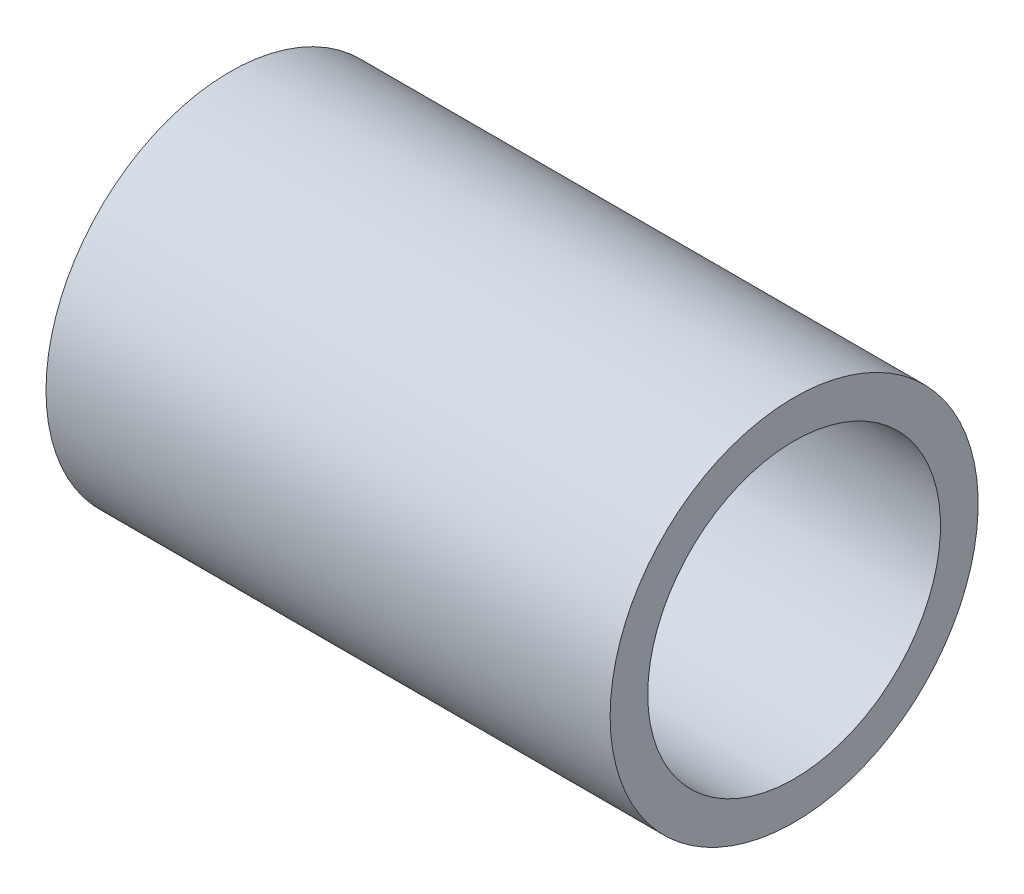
SolidWorks part; units mm, degrees
ref_plane "Front Plane" through (0, 0, 0) normal (0, 0, 1) x (1, 0, 0)
ref_plane "Top Plane" through (0, 0, 0) normal (0, 1, 0) x (1, 0, 0)
ref_plane "Right Plane" through (0, 0, 0) normal (1, 0, 0) x (0, 0, -1)
sketch "Sketch0" plane through (0, 0, 0) normal (0, 0, 1) x (1, 0, 0)
  line L0 (-20.7518, 0) -> (1.1938, 0) construction
  line L2 (-1.1938, 0) -> (1.1938, 0) construction
  line L3 (-20.7518, 0) -> (20.7518, 0) construction
  line L4 (-20.7518, 13.5382) -> (-20.7518, -13.5382) construction
  line L5 (-1.1938, 10.6172) -> (-20.7518, 10.7696) construction
  line L6 (-1.1938, 10.6172) -> (-1.1938, -10.6172) construction
  line L7 (-1.1938, -10.6172) -> (-20.7518, -10.7696) construction
  line L8 (-20.7518, 10.7696) -> (-20.7518, -10.7696) construction
  line L14 (-1.1938, 7.8994) -> (-1.1938, -7.8994) construction
  dimension "N" = 2.3876
  dimension "M" = 27.0764
  dimension "OD A" = 21.5392
  dimension "OD B" = 21.2344
  dimension "ID" = 15.7988
  dimension "L" = 41.5036
sketch "Sketch1" plane through (0, 0, 0) normal (0, 0, 1) x (1, 0, 0)
  line L0 (-20.7518, 0) -> (1.1938, 0) construction
  line L1 (-20.7518, 0) -> (1.1938, 0) construction
  line L2 (-1.1938, -7.8994) -> (1.1938, -7.8994)
  line L3 (20.7518, -10.7696) -> (1.1938, -10.6172)
  line L4 (-20.7518, -13.5382) -> (-20.7518, -10.7696)
  line L5 (-20.7518, -10.7696) -> (-1.1938, -10.6172)
  line L6 (20.7518, -13.5382) -> (20.7518, -10.7696)
  line L7 (-1.1938, -10.6172) -> (-1.1938, -7.8994)
  line L8 (1.1938, -10.6172) -> (1.1938, -7.8994)
  line L9 (20.7518, -13.5382) -> (-20.7518, -13.5382)
  line L10 (0, 0) -> (0, -7.8994) construction
revolve "Revolve1" add sketch "Sketch1" angle 360 about L1
